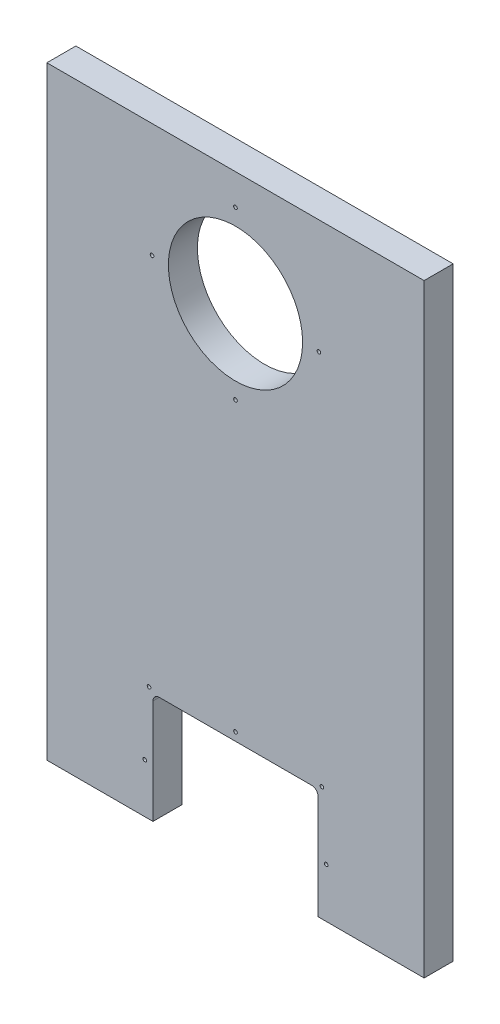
SolidWorks part; units mm, degrees
ref_plane "Спереди" through (0, 0, 0) normal (0, 0, 1) x (1, 0, 0)
ref_plane "Сверху" through (0, 0, 0) normal (0, 1, 0) x (1, 0, 0)
ref_plane "Справа" through (0, 0, 0) normal (1, 0, 0) x (0, 0, -1)
sketch "Эскиз1" plane through (0, 0, 0) normal (0, 0, 1) x (1, 0, 0)
  line L0 (104, -333) -> (104, 0) construction
  line L1 (0, 0) -> (208, 0)
  line L2 (0, 0) -> (0, -333)
  line L3 (0, -333) -> (208, -333)
  line L4 (208, 0) -> (208, -333)
  circle A1 centre (104, -63) radius 37
  circle A2 centre (58, -63) radius 1
  circle A3 centre (104, -17) radius 1
  circle A4 centre (150, -63) radius 1
  circle A5 centre (104, -109) radius 1
  dimension "D3" = 270
  dimension "D4" = 74
  dimension "D6" = 4
  dimension "D1" = 208
  dimension "D2" = 333
extrude "Вытянуть1" add sketch "Эскиз1" along normal blind 16
sketch "Эскиз2" plane through (0, 0, 16) normal (0, 0, 1) x (1, 0, 0)
  line L1 (62, -332.5) -> (146, -332.5) construction
  line L2 (62, -272.5) -> (146, -272.5) construction
  line L4 (59, -329.5) -> (59, -275.5) construction
  line L6 (149, -329.5) -> (149, -275.5) construction
  line L7 (58.5, -333) -> (149.5, -333)
  line L8 (149.5, -333) -> (149.5, -275.5)
  line L9 (62, -272) -> (146, -272)
  line L10 (58.5, -333) -> (58.5, -275.5)
  arc A0 (59, -275.5) -> (62, -272.5) centre (62, -275.5) cw construction
  arc A1 (149, -275.5) -> (146, -272.5) centre (146, -275.5) ccw construction
  arc A2 (149, -329.5) -> (146, -332.5) centre (146, -329.5) cw construction
  arc A3 (59, -329.5) -> (62, -332.5) centre (62, -329.5) ccw construction
  arc A5 (149.5, -275.5) -> (146, -272) centre (146, -275.5) ccw
  arc A6 (58.5, -275.5) -> (62, -272) centre (62, -275.5) cw
  dimension "D1" = 3
  dimension "D2" = 3
  dimension "D3" = 3
  dimension "D4" = 3
extrude "Вырез-Вытянуть1" cut sketch "Эскиз2" against normal blind 16
sketch "Эскиз3" plane through (0, 0, 16) normal (0, 0, 1) x (1, 0, 0)
  circle A0 centre (54, -305.7543) radius 1
  circle A1 centre (56.3431, -269.8431) radius 1
  circle A2 centre (104, -267.5) radius 1
  circle A3 centre (151.6569, -269.8431) radius 1
  circle A4 centre (154, -305.7543) radius 1
extrude "Вырез-Вытянуть2" cut sketch "Эскиз3" against normal blind 16
sketch "Эскиз4" plane through (0, 0, 0) normal (0, 0, -1) x (-1, 0, 0)
  circle A0 centre (-150, -63) radius 7
  circle A1 centre (-104, -17) radius 7
  circle A2 centre (-58, -63) radius 7
  circle A3 centre (-104, -109) radius 7
  point P3 (-104, -63)
  dimension "D1" = 4
